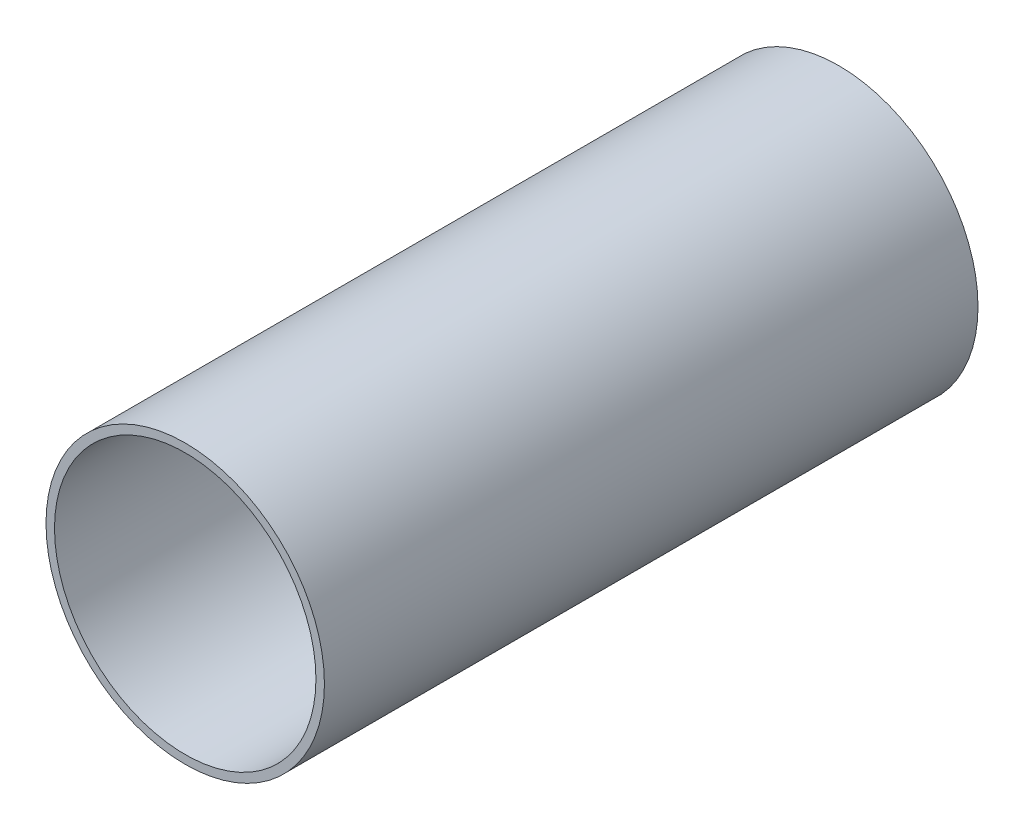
SolidWorks part; units mm, degrees
ref_plane "Front Plane" through (0, 0, 0) normal (0, 0, 1) x (1, 0, 0)
ref_plane "Top Plane" through (0, 0, 0) normal (0, 1, 0) x (1, 0, 0)
ref_plane "Right Plane" through (0, 0, 0) normal (1, 0, 0) x (0, 0, -1)
sketch "Sketch1" plane through (0, 0, 0) normal (0, 0, 1) x (1, 0, 0)
  circle A0 centre (0, 0) radius 27.051
  circle A1 centre (0, 0) radius 25.4
extrude "Extrude1" add sketch "Sketch1" along normal blind 127
